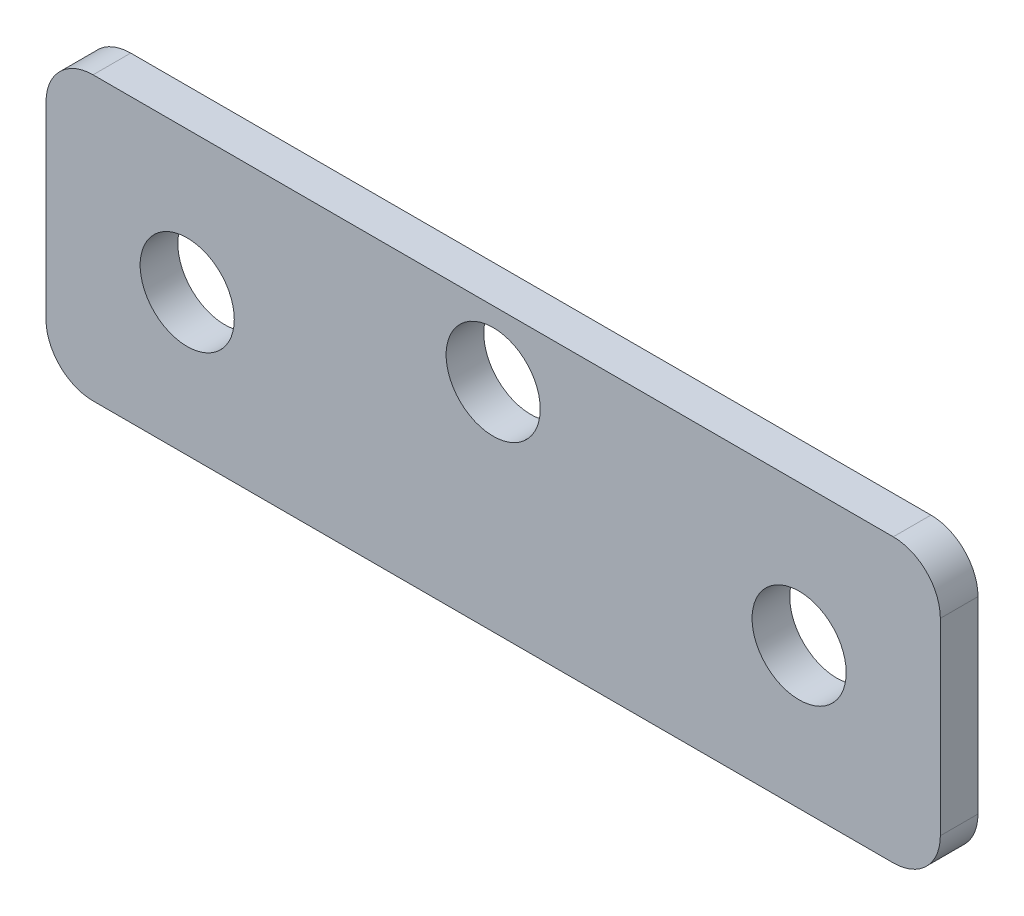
SolidWorks part; units mm, degrees
ref_plane "Plan1" through (0, 0, 0) normal (0, 0, 1) x (1, 0, 0)
ref_plane "Plan2" through (0, 0, 0) normal (0, 1, 0) x (1, 0, 0)
ref_plane "Plan3" through (0, 0, 0) normal (1, 0, 0) x (0, 0, -1)
sketch "Esquisse1" plane through (0, 0, 0) normal (0, 0, 1) x (1, 0, 0)
  line L0 (-75, 15) -> (10, 15)
  line L1 (-80, 10) -> (-80, -10)
  line L2 (10, -15) -> (-75, -15)
  line L3 (15, -10) -> (15, 10)
  circle A0 centre (0, 0) radius 5
  circle A1 centre (-65, 0) radius 5
  arc A2 (-80, 10) -> (-75, 15) centre (-75, 10) cw
  arc A3 (-75, -15) -> (-80, -10) centre (-75, -10) cw
  arc A4 (10, -15) -> (15, -10) centre (10, -10) ccw
  arc A5 (15, 10) -> (10, 15) centre (10, 10) ccw
  circle A6 centre (-32.5, 8) radius 5
  point P11 (-80, 15)
  point P18 (15, 15)
  dimension "D1" = 10
  dimension "D7" = 5
  dimension "D2" = 30
  dimension "D3" = 15
  dimension "D4" = 15
  dimension "D5" = 95
  dimension "D6" = 65
  dimension "D8" = 47.5
  dimension "D9" = 7
extrude "Base-Extrusion" add sketch "Esquisse1" along normal blind 4
